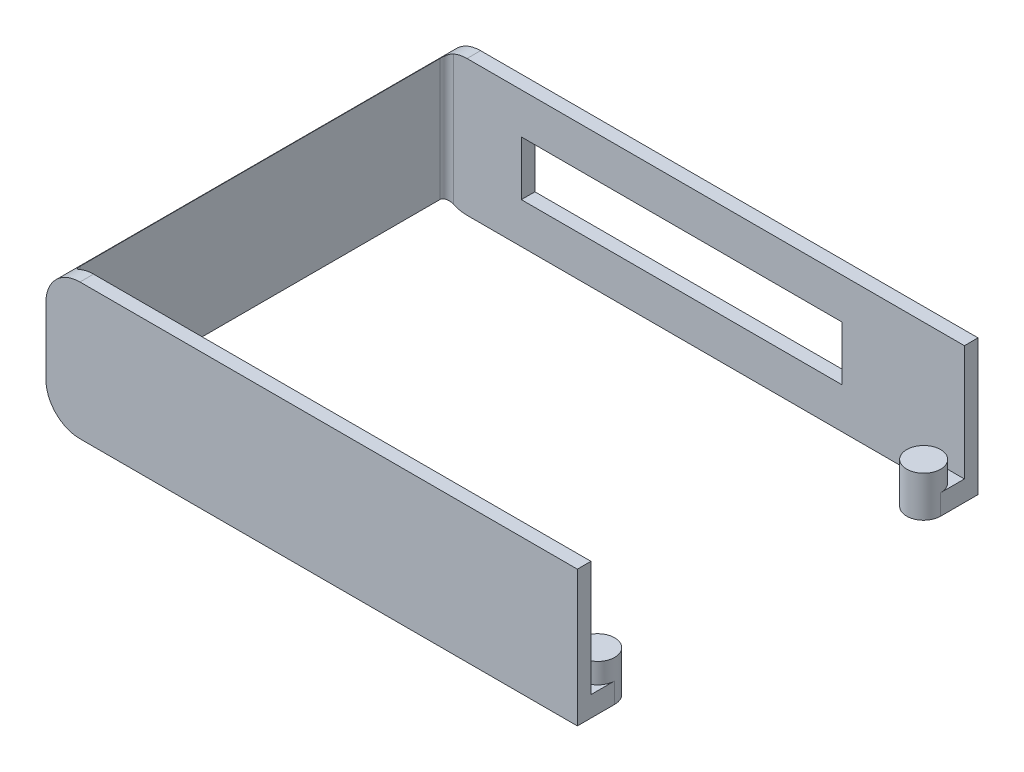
SolidWorks part; units mm, degrees
ref_plane "Front Plane" through (0, 0, 0) normal (0, 0, 1) x (1, 0, 0)
ref_plane "Top Plane" through (0, 0, 0) normal (0, 1, 0) x (1, 0, 0)
ref_plane "Right Plane" through (0, 0, 0) normal (1, 0, 0) x (0, 0, -1)
sketch "Sketch1" plane through (0, 0, 0) normal (0, 0, 1) x (1, 0, 0)
  line L1 (-39.125, 20) -> (39.125, 20)
  line L2 (-39.125, 20) -> (-39.125, 0)
  line L3 (-39.125, 0) -> (39.125, 0)
  line L4 (39.125, 20) -> (39.125, 0)
  dimension "D1" = 20
  dimension "D2" = 78.25
extrude "Extrude1" add sketch "Sketch1" along normal blind 2
sketch "Sketch7" plane through (0, 0, 2) normal (0, 0, 1) x (1, 0, 0)
  line L0 (-39.125, 0) -> (39.125, 0) construction
  line L1 (-39.125, 20) -> (-37.125, 20)
  line L2 (-39.125, 20) -> (-39.125, 0)
  line L3 (-39.125, 0) -> (-37.125, 0)
  line L4 (-37.125, 20) -> (-37.125, 0)
  dimension "D1" = 2
extrude "Extrude2" add sketch "Sketch7" along normal blind 27.5
sketch "Sketch10" plane through (0, 0, 0) normal (0, 1, 0) x (-1, 0, 0)
  line L0 (39.125, 0) -> (-39.125, 0) construction
  line L1 (-39.125, 0) -> (-34.125, 0)
  line L2 (-39.125, 0) -> (-39.125, 5.5)
  line L3 (-39.125, 2) -> (37.125, 2) construction
  line L4 (-34.125, 0) -> (-34.125, 5.5)
  arc A0 (-39.125, 5.5) -> (-34.125, 5.5) centre (-36.625, 5.5) cw
  dimension "D2" = 2.5
  dimension "D1" = 3.5
extrude "Extrude3" add sketch "Sketch10" along normal blind 3
sketch "Sketch11" plane through (0, 3, 0) normal (0, 1, 0) x (-1, 0, 0)
  circle A0 centre (-36.625, 5.5) radius 2.5
  arc A1 (-34.125, 5.5) -> (-39.125, 5.5) centre (-36.625, 5.5) ccw construction
extrude "Extrude4" add sketch "Sketch11" along normal blind 3
ref_plane "Plane1" through (0, 0, 29.5) normal (0, 0, 1) x (1, 0, 0)
mirror "Mirror3" about plane through (0, 0, 29.5) normal (0, 0, 1) of "Extrude1", "Extrude2"
sketch "Sketch12" plane through (0, 0, 57) normal (0, 0, 1) x (1, 0, 0)
  line L0 (39.125, 20) -> (-37.125, 20) construction
  line L1 (-39.125, 0) -> (39.125, 0)
  line L2 (-39.125, 0) -> (-39.125, 20)
  line L3 (-39.125, 20) -> (39.125, 20)
  line L4 (39.125, 0) -> (39.125, 20)
extrude "Extrude5" add sketch "Sketch12" along normal blind 2
mirror "Mirror4" about plane through (0, 0, 29.5) normal (0, 0, 1) of "Extrude3", "Extrude4"
fillet "Fillet4" radius 5 8 edges at (-39.125, 20, 29.5) (-39.125, 0, 29.5)
fillet "Fillet5" radius 1 2 edges
sketch "Sketch16" plane through (0, 0, 0) normal (0, 0, -1) x (-1, 0, 0)
  line L0 (39.125, 10) -> (-39.125, 10) construction
  line L1 (-21.125, 14) -> (26.125, 14)
  line L2 (-21.125, 14) -> (-21.125, 6)
  line L3 (-21.125, 6) -> (26.125, 6)
  line L4 (26.125, 14) -> (26.125, 6)
  line L5 (39.125, 15) -> (39.125, 5) construction
  line L7 (36.125, 19.5826) -> (36.125, 0.4174) construction
  line L8 (-39.125, 0) -> (-39.125, 20) construction
  dimension "D1" = 8
  dimension "D2" = 18
  dimension "D3" = 10
extrude "Cut-Extrude4" cut sketch "Sketch16" against normal up to next
